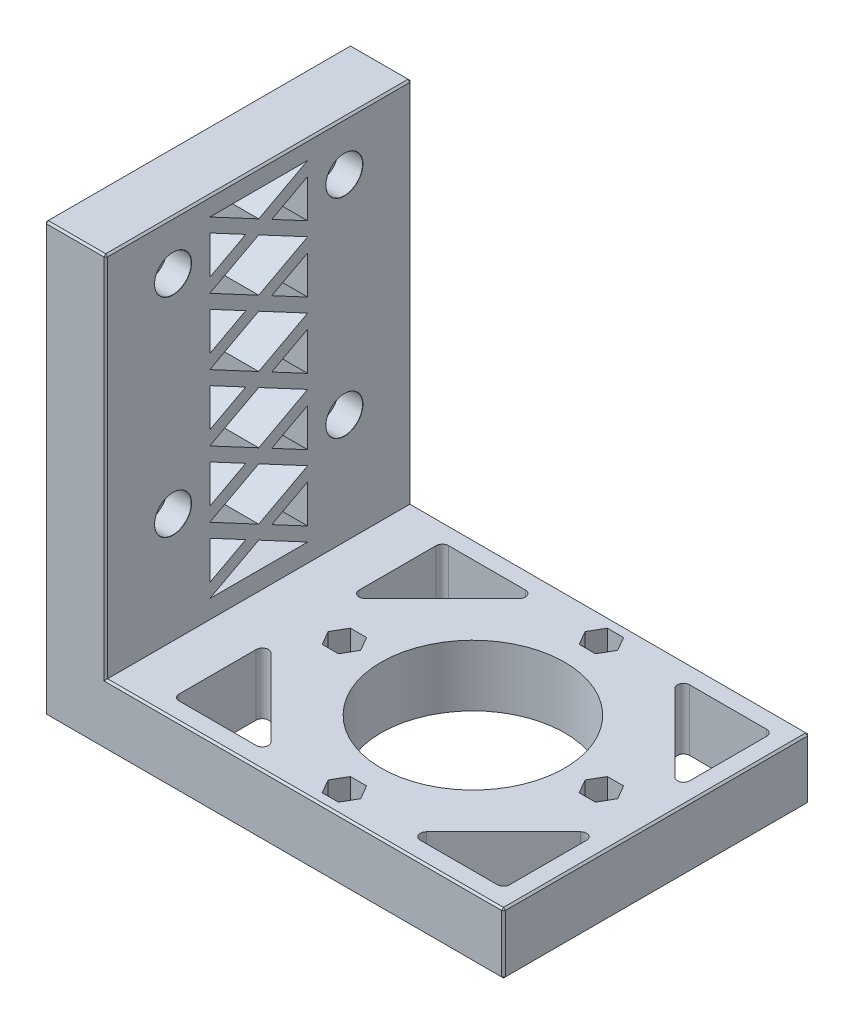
SolidWorks part; units mm, degrees
ref_plane "前视基准面" through (0, 0, 0) normal (0, 0, 1) x (1, 0, 0)
ref_plane "上视基准面" through (0, 0, 0) normal (0, 1, 0) x (1, 0, 0)
ref_plane "右视基准面" through (0, 0, 0) normal (1, 0, 0) x (0, 0, -1)
other "Configuration Table"
sketch "草图1" plane through (0, 0, 0) normal (0, 0, 1) x (1, 0, 0)
  line L0 (0, 70) -> (0, 0)
  line L1 (0, 0) -> (75, 0)
  line L2 (75, 0) -> (75, 10)
  line L3 (75, 10) -> (10, 10)
  line L4 (10, 10) -> (10, 70)
  line L5 (10, 70) -> (0, 70)
  dimension "D1" = 10
  dimension "D2" = 10
  dimension "D3" = 65
  dimension "D4" = 60
extrude "凸台-拉伸1" add sketch "草图1" along normal mid plane 50
hole_wizard "M3 六角圆柱头螺钉的柱形沉头孔1" positions "草图2" profile "草图3" counterbore size "M3" standard "GB"
sketch "草图2" plane through (10, 0, 0) normal (1, 0, 0) x (0, 0, -1)
  line L1 (14, 28) -> (-14, 28)
  line L2 (14, 28) -> (14, 62)
  line L3 (14, 62) -> (-14, 62)
  line L4 (-14, 28) -> (-14, 62)
  line L5 (14, 28) -> (-14, 62) construction
  line L6 (14, 62) -> (-14, 28) construction
  line L7 (-25, 70) -> (25, 70) construction
  point P1 (0, 45)
  dimension "D1" = 28
  dimension "D2" = 34
  dimension "D3" = 8
sketch "草图3" plane through (10, 28, 14) normal (0, 1, 0) x (0, 0, -1)
  line L0 (0, 0) -> (0, 10)
  line L1 (0, 10) -> (1.7, 10)
  line L3 (1.7, 10) -> (1.7, 4)
  line L4 (3, 4) -> (1.7, 4)
  line L5 (3, 4) -> (3, 0.025)
  line L6 (3, 0.025) -> (3.025, 0)
  line L7 (3.025, 0) -> (0, 0)
  line L8 (-3, 0.025) -> (-3.025, 0) construction
  line L11 (0, -6.35) -> (0, 107.95) construction
  dimension "通孔孔直径" = 3.4
  dimension "通孔孔深度" = 10
  dimension "柱形沉头孔直径" = 6
  dimension "柱形沉头孔深度" = 4
  dimension "近端锥形沉头孔直径" = 6.05
  dimension "近端锥形沉头孔角度" = 90
sketch "草图7" plane through (0, 10, 0) normal (0, 1, 0) x (1, 0, 0)
  line L0 (75, -25) -> (75, 25) construction
  line L2 (26.6558, 0) -> (25.3279, 2.3)
  line L3 (25.3279, 2.3) -> (22.6721, 2.3)
  line L4 (22.6721, 2.3) -> (21.3442, 0)
  line L5 (21.3442, 0) -> (22.6721, -2.3)
  line L6 (22.6721, -2.3) -> (25.3279, -2.3)
  line L7 (25.3279, -2.3) -> (26.6558, 0)
  line L8 (47.6558, 21) -> (46.3279, 23.3)
  line L9 (46.3279, 23.3) -> (43.6721, 23.3)
  line L10 (43.6721, 23.3) -> (42.3442, 21)
  line L11 (42.3442, 21) -> (43.6721, 18.7)
  line L12 (43.6721, 18.7) -> (46.3279, 18.7)
  line L13 (46.3279, 18.7) -> (47.6558, 21)
  line L14 (63.3442, 0) -> (64.6721, -2.3)
  line L15 (64.6721, -2.3) -> (67.3279, -2.3)
  line L16 (67.3279, -2.3) -> (68.6558, 0)
  line L17 (68.6558, 0) -> (67.3279, 2.3)
  line L18 (67.3279, 2.3) -> (64.6721, 2.3)
  line L19 (64.6721, 2.3) -> (63.3442, 0)
  line L20 (47.6558, -21) -> (46.3279, -18.7)
  line L21 (46.3279, -18.7) -> (43.6721, -18.7)
  line L22 (43.6721, -18.7) -> (42.3442, -21)
  line L23 (42.3442, -21) -> (43.6721, -23.3)
  line L24 (43.6721, -23.3) -> (46.3279, -23.3)
  line L25 (46.3279, -23.3) -> (47.6558, -21)
  circle A0 centre (45, 0) radius 21 construction
  circle A1 centre (24, 0) radius 2.3 construction
  circle A2 centre (45, 21) radius 2.3 construction
  circle A3 centre (66, 0) radius 2.3 construction
  circle A4 centre (45, -21) radius 2.3 construction
  dimension "D1" = 42
  dimension "D2" = 30
  dimension "D3" = 4.6
extrude "切除-拉伸1" cut sketch "草图7" against normal blind 5
sketch "草图8" plane through (0, 10, 0) normal (0, 1, 0) x (1, 0, 0)
  line L0 (75, -25) -> (75, 25) construction
  circle A0 centre (45, 0) radius 21
  dimension "D1" = 30
  dimension "D2" = 42
chamfer "倒角1" distance 0.3 angle 45 17 edges at (0, 0, 0) (75, 0, 0) (75, 10, 0) (10, 70, 0) (0, 35, -25) (37.5, 0, -25) (75, 5, -25) (42.5, 10, -25) (10, 40, -25) (5, 70, -25) (0, 70, 0) (10, 40, 25) (42.5, 10, 25) (75, 5, 25) (37.5, 0, 25) (0, 35, 25) (5, 70, 25)
sketch "草图9" plane through (10, 0, 0) normal (1, 0, 0) x (0, 0, -1)
  line L0 (-24.7, 70) -> (24.7, 70) construction
  line L1 (8, 13) -> (-8, 13)
  line L2 (8, 13) -> (8, 67)
  line L3 (8, 67) -> (-8, 67)
  line L4 (-8, 13) -> (-8, 67)
  line L5 (8, 13) -> (-8, 67) construction
  line L6 (8, 67) -> (-8, 13) construction
  line L7 (21, 10) -> (-21, 10) construction
  point P0 (0, 40)
  point P7 (0, 0)
  dimension "D1" = 3
  dimension "D2" = 3
  dimension "D3" = 16
extrude "切除-拉伸2" cut sketch "草图9" against normal through all
sketch "草图10" plane through (10, 0, 0) normal (1, 0, 0) x (0, 0, -1)
  line L0 (-8, 67) -> (-8, 64.7333)
  line L1 (-8, 67) -> (-8, 13) construction
  line L2 (-8, 64.7333) -> (8, 56.2)
  line L3 (8, 13) -> (8, 67) construction
  line L4 (8, 56.2) -> (8, 58.4667)
  line L5 (8, 58.4667) -> (-8, 67)
  line L6 (8, 67) -> (8, 64.7333)
  line L7 (8, 64.7333) -> (-8, 56.2)
  line L8 (-8, 56.2) -> (-8, 58.4667)
  line L9 (-8, 58.4667) -> (8, 67)
  line L10 (-8, 56.2) -> (-8, 53.9333)
  line L11 (-8, 53.9333) -> (8, 45.4)
  line L12 (8, 45.4) -> (8, 47.6667)
  line L13 (8, 47.6667) -> (-8, 56.2)
  line L14 (8, 56.2) -> (8, 53.9333)
  line L15 (8, 53.9333) -> (-8, 45.4)
  line L16 (-8, 45.4) -> (-8, 47.6667)
  line L17 (-8, 47.6667) -> (8, 56.2)
  line L18 (-8, 45.4) -> (-8, 43.1333)
  line L19 (-8, 43.1333) -> (8, 34.6)
  line L20 (8, 34.6) -> (8, 36.8667)
  line L21 (8, 36.8667) -> (-8, 45.4)
  line L22 (8, 45.4) -> (8, 43.1333)
  line L23 (8, 43.1333) -> (-8, 34.6)
  line L24 (-8, 34.6) -> (-8, 36.8667)
  line L25 (-8, 36.8667) -> (8, 45.4)
  line L26 (-8, 34.6) -> (-8, 32.3333)
  line L27 (-8, 32.3333) -> (8, 23.8)
  line L28 (8, 23.8) -> (8, 26.0667)
  line L29 (8, 26.0667) -> (-8, 34.6)
  line L30 (8, 34.6) -> (8, 32.3333)
  line L31 (8, 32.3333) -> (-8, 23.8)
  line L32 (-8, 23.8) -> (-8, 26.0667)
  line L33 (-8, 26.0667) -> (8, 34.6)
  line L34 (-8, 23.8) -> (-8, 21.5333)
  line L35 (-8, 21.5333) -> (8, 13)
  line L36 (8, 13) -> (8, 15.2667)
  line L37 (8, 15.2667) -> (-8, 23.8)
  line L38 (8, 23.8) -> (8, 21.5333)
  line L39 (8, 21.5333) -> (-8, 13)
  line L40 (-8, 13) -> (-8, 15.2667)
  line L41 (-8, 15.2667) -> (8, 23.8)
  point P12 (0, 0)
  point P15 (8, 13)
  point P49 (8, 56.075)
  dimension "D1" = 2
  dimension "D2" = 2
  dimension "D3" = 5
extrude "凸台-拉伸2" add sketch "草图10" against normal up to surface (10 mm away) contours L2 L9 L5 M6 | L9 L5 L7 M8 | L9 L2 L7 L5 | L9 L7 L2 M6 | L5 L7 L2 M8 | L11 L17 L13 M6 | L17 L11 L15 L13 | L17 L13 L15 M8 | L13 L15 L11 M8 | L17 L15 L11 M6 | L19 L25 L21 M6 | L25 L19 L23 L21 | L25 L21 L23 M8 | L21 L23 L19 M8 | L25 L23 L19 M6 | L27 L33 L29 M6 | L33 L27 L31 L29 | L33 L29 L31 M8 | L29 L31 L27 M8 | L33 L31 L27 M6 | L35 L41 L37 M6 | L41 L35 L39 L37 | L41 L37 L39 M8 | L37 L39 L35 M8 | L41 L39 L35 M6
sketch "草图11" plane through (0, 10, 0) normal (0, 1, 0) x (1, 0, 0)
  circle A0 centre (45, 0) radius 15
  dimension "D1" = 30
extrude "切除-拉伸3" cut sketch "草图11" against normal through all
sketch "草图12" plane through (0, 10, 0) normal (0, 1, 0) x (1, 0, 0)
  line L0 (58.4142, 22) -> (71, 22)
  line L1 (72, 21) -> (72, 8.4142)
  line L2 (70.2929, 7.7071) -> (57.7071, 20.2929)
  line L3 (45, 0) -> (45, 31.5406) construction
  line L4 (45, 0) -> (89.3608, 0) construction
  line L5 (70.2929, -7.7071) -> (57.7071, -20.2929)
  line L6 (72, -21) -> (72, -8.4142)
  line L7 (58.4142, -22) -> (71, -22)
  line L8 (19.7071, 7.7071) -> (32.2929, 20.2929)
  line L9 (18, 21) -> (18, 8.4142)
  line L10 (31.5858, 22) -> (19, 22)
  line L11 (31.5858, -22) -> (19, -22)
  line L12 (18, -21) -> (18, -8.4142)
  line L13 (19.7071, -7.7071) -> (32.2929, -20.2929)
  line L14 (9.7, 25) -> (74.7, 25) construction
  line L15 (75, 24.7) -> (75, -24.7) construction
  arc A0 (19, -22) -> (18, -21) centre (19, -21) cw
  arc A1 (18, -8.4142) -> (19.7071, -7.7071) centre (19, -8.4142) cw
  arc A2 (31.5858, -22) -> (32.2929, -20.2929) centre (31.5858, -21) ccw
  arc A3 (57.7071, -20.2929) -> (58.4142, -22) centre (58.4142, -21) ccw
  arc A4 (72, -21) -> (71, -22) centre (71, -21) cw
  arc A5 (70.2929, -7.7071) -> (72, -8.4142) centre (71, -8.4142) cw
  arc A6 (72, 8.4142) -> (70.2929, 7.7071) centre (71, 8.4142) cw
  arc A7 (71, 22) -> (72, 21) centre (71, 21) cw
  arc A8 (58.4142, 22) -> (57.7071, 20.2929) centre (58.4142, 21) ccw
  arc A9 (18, 21) -> (19, 22) centre (19, 21) cw
  arc A10 (32.2929, 20.2929) -> (31.5858, 22) centre (31.5858, 21) ccw
  arc A11 (19.7071, 7.7071) -> (18, 8.4142) centre (19, 8.4142) cw
  point P23 (18, -22)
  point P26 (18, -6)
  point P29 (34, -22)
  point P32 (56, -22)
  point P35 (72, -22)
  point P38 (72, -6)
  point P41 (72, 6)
  point P44 (72, 22)
  point P47 (56, 22)
  point P50 (18, 22)
  point P53 (34, 22)
  point P56 (18, 6)
  dimension "D5" = 1
  dimension "D1" = 3
  dimension "D2" = 3
  dimension "D3" = 45
  dimension "D4" = 16
extrude "切除-拉伸4" cut sketch "草图12" against normal through all
